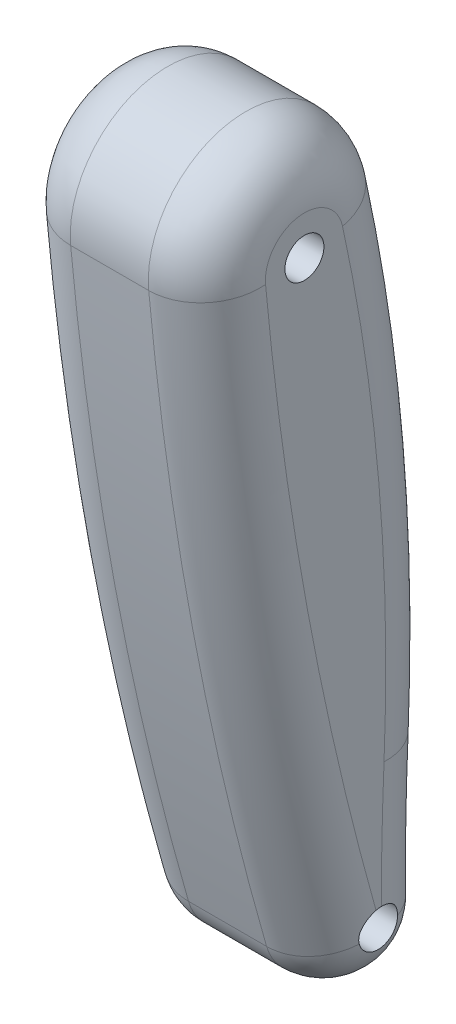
SolidWorks part; units mm, degrees
ref_plane "XY" through (0, 0, 0) normal (0, 0, 1) x (1, 0, 0)
ref_plane "YZ" through (0, 0, 0) normal (0, 1, 0) x (1, 0, 0)
ref_plane "XZ" through (0, 0, 0) normal (1, 0, 0) x (0, 0, -1)
sketch "Sketch7" plane through (0, 0, 0) normal (1, 0, 0) x (0, 0, -1)
  line L1 (-24.1632, -755.7123) -> (25.9157, -1159.015) construction
  line L2 (0, 432.2232) -> (0, -432.2232) construction
  arc A0 (37.8855, -742.2138) -> (-87.3963, -761.529) centre (-24.1632, -755.7123) ccw
  arc A1 (-10.7018, -1169.5397) -> (64.015, -1158.7778) centre (25.9157, -1159.015) ccw
  arc A2 (-10.7018, -1169.5397) -> (-87.3963, -761.529) centre (2113.1133, -559.109) cw
  arc A3 (37.8855, -742.2138) -> (65.7157, -1067.2864) centre (-1203.0883, -1012.1842) cw
  arc A4 (64.015, -1158.7778) -> (65.7157, -1067.2864) centre (1908.0143, -1147.2947) cw
  dimension "D1" = 406.4
  dimension "D2" = 38.1
  dimension "D3" = 63.5
  dimension "D4" = 1270
  dimension "D5" = 50.8
  dimension "D6" = 2209.8
  dimension "D8" = 1844.0351
  dimension "D7" = 7.078
extrude "Base-Extrude" add sketch "Sketch7" along normal mid plane 127
fillet "Fillet1" radius 38.1
sketch "Sketch8" plane through (-63.5, 0, 0) normal (-1, 0, 0) x (0, 0, 1)
  circle A0 centre (24.1632, -755.7123) radius 12.7
  circle A1 centre (-25.9157, -1159.015) radius 12.7
  arc A2 (49.4564, -758.039) -> (-0.6563, -750.3129) centre (24.1632, -755.7123) ccw construction
  arc A3 (-64.015, -1158.7778) -> (10.7018, -1169.5397) centre (-25.9157, -1159.015) ccw construction
  dimension "D1" = 25.4
extrude "Cut-Extrude1" cut sketch "Sketch8" against normal through all
